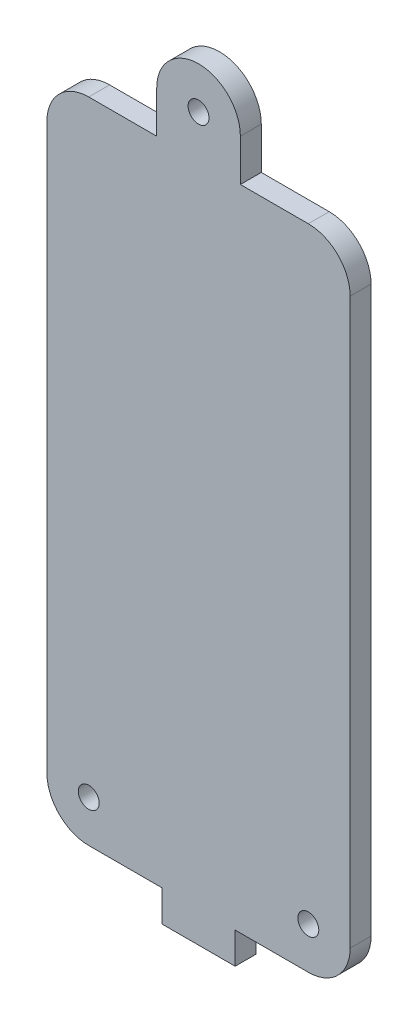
SolidWorks part; units mm, degrees
ref_plane "Спереди" through (0, 0, 0) normal (0, 0, 1) x (1, 0, 0)
ref_plane "Сверху" through (0, 0, 0) normal (0, 1, 0) x (1, 0, 0)
ref_plane "Справа" through (0, 0, 0) normal (1, 0, 0) x (0, 0, -1)
sketch "Эскиз1" plane through (0, 0, 0) normal (0, 0, 1) x (1, 0, 0)
  line L0 (0, 0) -> (0, 73) construction
  line L1 (3.5, 0) -> (-3.5, 0)
  line L2 (-3.5, 0) -> (-3.5, 3)
  line L3 (-3.5, 3) -> (-10.5, 3)
  line L4 (-14.5, 7) -> (-14.5, 61)
  line L5 (-10.5, 65) -> (-4, 65)
  line L6 (-4, 65) -> (-4, 69)
  line L7 (3.5, 0) -> (3.5, 3)
  line L8 (3.5, 3) -> (10.5, 3)
  line L9 (14.5, 7) -> (14.5, 61)
  line L10 (10.5, 65) -> (4, 65)
  line L11 (4, 65) -> (4, 69)
  arc A0 (-4, 69) -> (4, 69) centre (0, 69) cw
  arc A1 (-14.5, 61) -> (-10.5, 65) centre (-10.5, 61) cw
  arc A2 (-10.5, 3) -> (-14.5, 7) centre (-10.5, 7) cw
  arc A3 (10.5, 3) -> (14.5, 7) centre (10.5, 7) ccw
  arc A4 (14.5, 61) -> (10.5, 65) centre (10.5, 61) ccw
  point P10 (0, 73)
  point P15 (0, 0)
  point P16 (0, 76.7362)
  dimension "D2" = 4
  dimension "D4" = 4
  dimension "D1" = 29
  dimension "D3" = 4
  dimension "D5" = 62
  dimension "D6" = 3
  dimension "D7" = 7
extrude "Бобышка-Вытянуть1" add sketch "Эскиз1" along normal blind 2
sketch "Эскиз2" plane through (0, 0, 2) normal (0, 0, 1) x (1, 0, 0)
  circle A0 centre (0, 69) radius 1
  circle A1 centre (10.5, 7) radius 1
  circle A2 centre (-10.5, 7) radius 1
  dimension "D1" = 2
extrude "Вырез-Вытянуть1" cut sketch "Эскиз2" against normal through all
